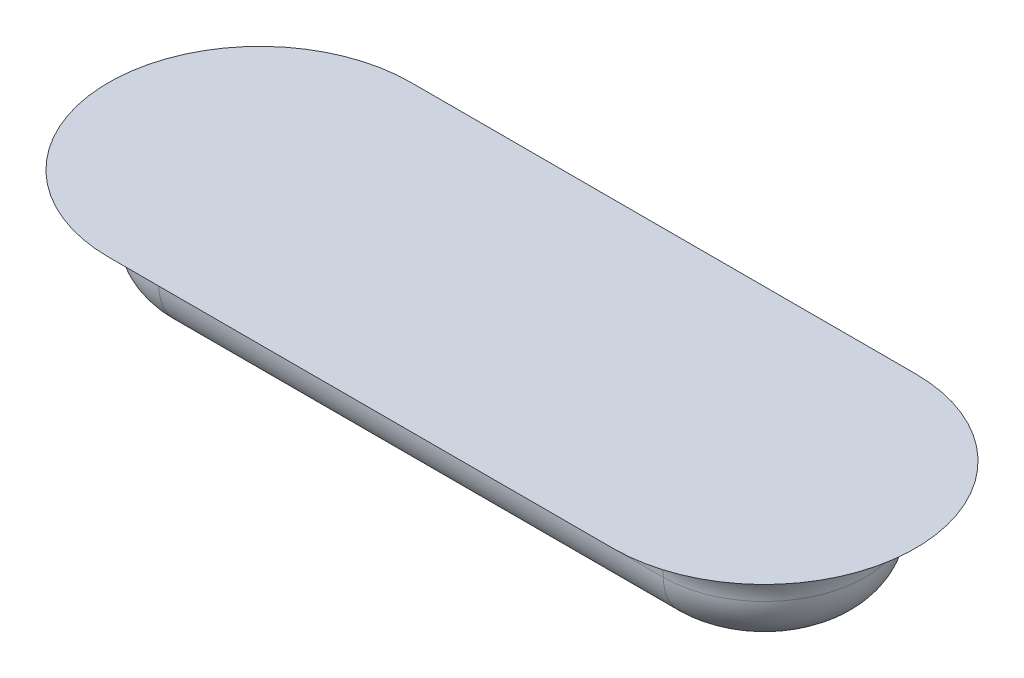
SolidWorks part; units mm, degrees
ref_plane "Front" through (0, 0, 0) normal (0, 0, 1) x (1, 0, 0)
ref_plane "Top" through (0, 0, 0) normal (0, 1, 0) x (1, 0, 0)
ref_plane "Right" through (0, 0, 0) normal (1, 0, 0) x (0, 0, -1)
sketch "Sketch1" plane through (0, 0, 0) normal (0, 1, 0) x (1, 0, 0)
  line L1 (-120.8151, 90.7929) -> (137.2789, 90.7929)
  line L2 (-120.8151, 90.7929) -> (-120.8151, -99.9932)
  line L3 (-120.8151, -99.9932) -> (137.2789, -99.9932)
  line L4 (137.2789, 90.7929) -> (137.2789, -99.9932)
extrude "Extrude1" add sketch "Sketch1" along normal blind 31.496
sketch "Sketch2" plane through (0, 0, 0) normal (0, 1, 0) x (-1, 0, 0)
  line L0 (37.111, 0) -> (-26.4339, 0) construction
  line L1 (37.111, 12.7) -> (-26.4339, 12.7)
  line L2 (37.111, -12.7) -> (-26.4339, -12.7)
  arc A0 (37.111, 12.7) -> (37.111, -12.7) centre (37.111, 0) cw
  arc A1 (-26.4339, 12.7) -> (-26.4339, -12.7) centre (-26.4339, 0) ccw
  dimension "D1" = 12.7
  dimension "D2" = 12.7
extrude "Extrude2" add sketch "Sketch2" against normal blind 12.7
fillet "Fillet1" radius 6.35 8 edges at (-49.811, -12.7, 0) (-5.3386, -12.7, -12.7) (39.1339, -12.7, 0) (-5.3386, -12.7, 12.7) (-49.811, 0, 0) (-5.3386, 0, -12.7) (39.1339, 0, 0) (-5.3386, 0, 12.7)
sketch "Sketch3" plane through (0, 0, 0) normal (0, 1, 0) x (-1, 0, 0)
  line L4 (120.8151, -90.7929) -> (120.8151, 99.9932)
  line L5 (120.8151, 99.9932) -> (-137.2789, 99.9932)
  line L6 (-137.2789, 99.9932) -> (-137.2789, -90.7929)
  line L7 (-137.2789, -90.7929) -> (120.8151, -90.7929)
  line L8 (120.8151, -90.7929) -> (120.8151, 99.9932)
  line L9 (120.8151, 99.9932) -> (-137.2789, 99.9932)
  line L10 (-137.2789, 99.9932) -> (-137.2789, -90.7929)
  line L11 (-137.2789, -90.7929) -> (120.8151, -90.7929)
  dimension "D1" = 0
extrude "Cut-Extrude1" cut sketch "Sketch3" along normal through all
